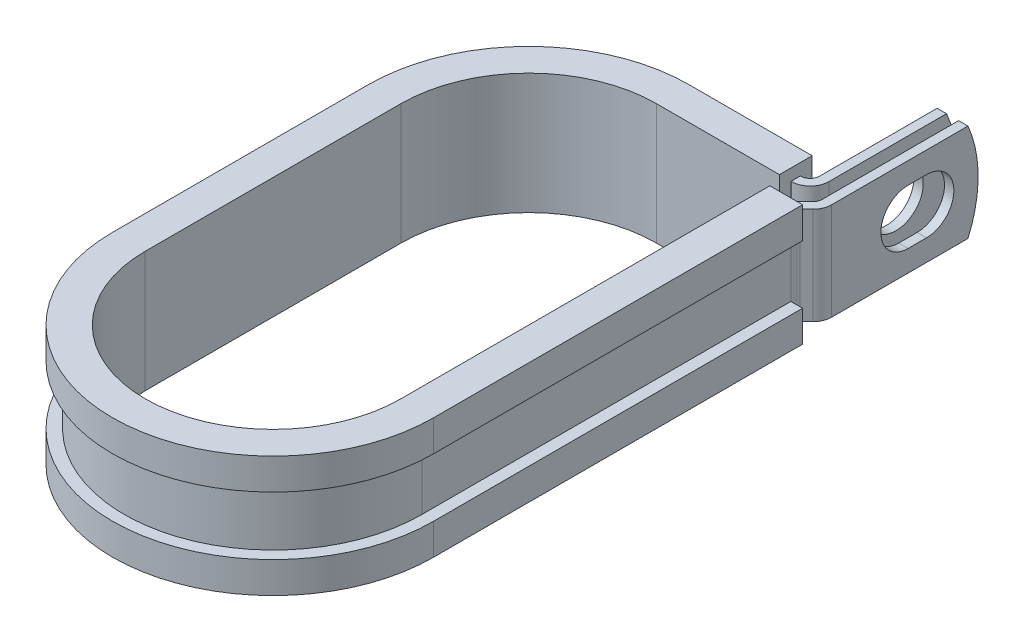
SolidWorks part; units mm, degrees
ref_plane "Front Plane" through (0, 0, 0) normal (0, 0, 1) x (1, 0, 0)
ref_plane "Top Plane" through (0, 0, 0) normal (0, 1, 0) x (1, 0, 0)
ref_plane "Right Plane" through (0, 0, 0) normal (1, 0, 0) x (0, 0, -1)
sketch "Sketch1" plane through (0, 0, 0) normal (0, 1, 0) x (1, 0, 0)
  line L0 (0, 18.1864) -> (16.0707, 18.1864)
  line L1 (18.1864, 0) -> (18.1864, 14.7739)
  line L2 (18.5091, 37.2872) -> (18.5091, 20.6248)
  line L3 (18.9006, 16.4981) -> (19.7268, 17.3243)
  line L4 (-18.1864, 0) -> (-18.1864, -33.3248)
  line L5 (20.0839, 18.1864) -> (20.0839, 37.2872)
  line L6 (18.1864, 0) -> (18.1864, -33.3248)
  arc A0 (0, 18.1864) -> (-18.1864, 0) centre (0, 0) ccw
  arc A1 (18.9006, 16.4981) -> (18.1864, 14.7739) centre (20.6248, 14.7739) ccw
  arc A2 (19.7268, 17.3243) -> (20.0839, 18.1864) centre (18.8647, 18.1864) ccw
  arc A3 (16.0707, 18.1864) -> (18.5091, 20.6248) centre (16.0707, 20.6248) ccw
  arc A4 (-18.1864, -33.3248) -> (18.1864, -33.3248) centre (0, -33.3248) ccw
extrude "Extrude-Thin1" add sketch "Sketch1" along normal mid plane 12.7 thin
sketch "Sketch2" plane through (17.2899, 0, 0) normal (-1, 0, 0) x (0, 0, 1)
  line L0 (-37.2872, 6.35) -> (-37.2872, -6.35) construction
  line L1 (0, 6.35) -> (0, -6.35) construction
  circle A0 centre (-29.3624, 0) radius 3.5687
  point P2 (-37.2872, 0)
extrude "Cut-Extrude1" cut sketch "Sketch2" against normal up to surface (1.2192 mm away)
sketch "Sketch3" plane through (21.3031, 0, 0) normal (1, 0, 0) x (0, 0, -1)
  line L0 (28.1686, 0) -> (30.5562, 0) construction
  line L1 (28.1686, 3.5687) -> (30.5562, 3.5687)
  line L2 (28.1686, -3.5687) -> (30.5562, -3.5687)
  line L3 (37.2872, 6.35) -> (37.2872, -6.35) construction
  arc A0 (28.1686, 3.5687) -> (28.1686, -3.5687) centre (28.1686, 0) ccw
  arc A1 (30.5562, -3.5687) -> (30.5562, 3.5687) centre (30.5562, 0) ccw
  point P3 (29.3624, 0)
  point P8 (37.2872, 0)
  point P11 (24.5999, 0)
  point P12 (34.1249, 0)
extrude "Cut-Extrude2" cut sketch "Sketch3" against normal up to surface (1.2192 mm away)
sketch "Sketch4" plane through (17.2899, 0, 0) normal (-1, 0, 0) x (0, 0, 1)
  line L0 (-37.2872, 6.35) -> (-37.2872, -6.35)
  line L1 (-37.2872, 6.35) -> (-35.9619, 6.35)
  line L2 (-37.2872, 6.35) -> (-20.6248, 6.35) construction
  line L3 (-37.2872, -6.35) -> (-35.9619, -6.35)
  line L4 (-37.2872, -6.35) -> (-20.6248, -6.35) construction
  arc A0 (-35.9619, 6.35) -> (-35.9619, -6.35) centre (-21.4122, 0) ccw
extrude "Cut-Extrude3" cut sketch "Sketch4" against normal through all contours A0 M4 M5 | A0 L0 M2
ref_plane "Plane1" through (0, 0, -14.7739) normal (0, 0, -1) x (-1, 0, 0)
ref_plane "Plane2" through (16.0199, 0, 0) normal (-1, 0, 0) x (0, 0, 1)
sketch "Sketch5" plane through (0, 0, -14.7739) normal (0, 0, -1) x (-1, 0, 0)
  line L0 (-19.4056, 6.35) -> (-18.1864, 6.35)
  line L1 (-19.4056, 6.35) -> (-19.4056, -6.35) construction
  line L3 (-18.1864, 6.35) -> (-18.1864, -6.35)
  line L4 (-18.1864, -6.35) -> (-19.4056, -6.35)
  line L5 (-19.4056, -6.35) -> (-19.4056, -3.81)
  line L6 (-19.4056, 6.35) -> (-19.4056, 3.81)
  line L7 (-20.9296, 7.874) -> (-20.9296, 3.81)
  line L8 (-20.9296, 7.874) -> (-16.6624, 7.874)
  line L9 (-16.6624, 7.874) -> (-16.6624, -7.874)
  line L10 (-16.6624, -7.874) -> (-20.9296, -7.874)
  line L11 (-20.9296, -7.874) -> (-20.9296, -3.81)
  line L12 (-20.9296, 3.81) -> (-19.4056, 3.81)
  line L13 (-19.4056, -3.81) -> (-20.9296, -3.81)
sketch "Sketch6" plane through (0, 6.35, 0) normal (0, 1, 0) x (1, 0, 0)
  line L0 (16.6624, 0) -> (16.6624, 14.7739)
  line L1 (16.6624, 14.7739) -> (20.9296, 14.7739) construction
  line L2 (16.0199, 6.9878) -> (16.0199, -6.9878) construction
  line L3 (16.6624, -33.3248) -> (16.6624, 0)
  line L4 (-16.6624, -33.3248) -> (-16.6624, 0)
  line L5 (0, 16.6624) -> (16.0199, 16.6624)
  arc A0 (0, 16.6624) -> (-16.6624, 0) centre (0, 0) ccw
  arc A1 (-16.6624, -33.3248) -> (16.6624, -33.3248) centre (0, -33.3248) ccw
sweep "Sweep1" add profiles "Sketch5" path "Sketch6"
equation "\"D4@Sketch5\" = \"D1@Extrude-Thin1\""
equation "\"D5@Sketch5\" = \"D5@Extrude-Thin1\""
equation "\"D1@Sketch3\" = \"D2@Sketch2\""
equation "\"D7@Sketch1\" = \"D3@Sketch2\" + \"D1@Sketch3\""
equation "\"D1@Sketch1\" = \"D1@Sketch6\" + 2 * \"D3@Sketch5\""
equation "\"D1@Sketch4\" = ( \"D1@Extrude-Thin1\" + .125 ) * 2"
equation "\"D9@Sketch1\"= \"D5@Extrude-Thin1\""
equation "\"D8@Sketch1\"= 2 * \"D5@Extrude-Thin1\""
equation "\"D2@Sketch1\" = 2 * \"D5@Extrude-Thin1\""
equation "\"D2@Sketch3\" = \"D1@Sketch2\""
equation "\"D6@Sketch1\" = \"D1@Sketch1\""
equation "\"D3@Sketch1\" = \"D1@Sketch6\""
